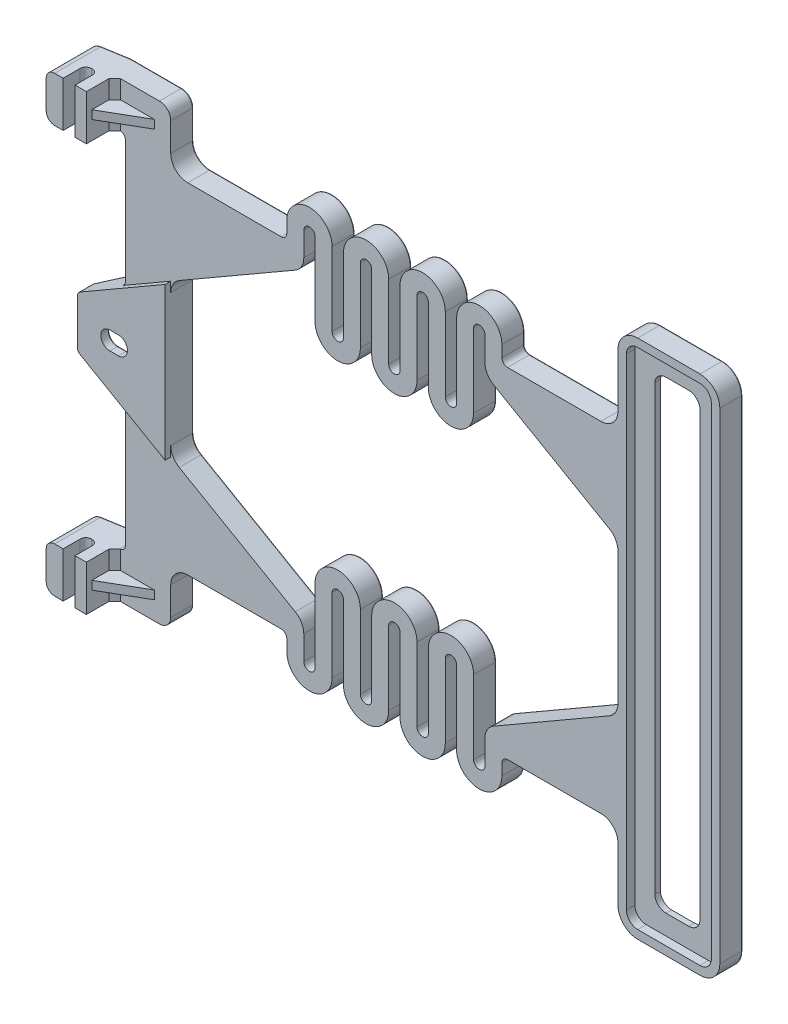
SolidWorks part; units mm, degrees
ref_plane "Face" through (0, 0, 0) normal (0, 0, 1) x (1, 0, 0)
ref_plane "Dessus" through (0, 0, 0) normal (0, 1, 0) x (1, 0, 0)
ref_plane "Droite" through (0, 0, 0) normal (1, 0, 0) x (0, 0, -1)
sketch "Esquisse1" plane through (0, 0, 0) normal (0, 0, 1) x (1, 0, 0)
  line L0 (0, 0) -> (-48.5, 0) construction
  line L1 (-21, 30) -> (-16, 30)
  line L2 (-16, 30) -> (-16, -30)
  line L3 (-21, -30) -> (-16, -30)
  line L4 (-21, -30) -> (-21, 30)
  point P8 (-16, 0)
  dimension "D1" = 16
  dimension "D2" = 60
  dimension "D3" = 5
extrude "Extrusion1" add sketch "Esquisse1" along normal mid plane 4
sketch "Esquisse2" plane through (0, 0, 0) normal (0, 0, 1) x (1, 0, 0)
  line L0 (-17.5, 30) -> (-17.5, 33)
  line L1 (-16, 30) -> (-21, 30) construction
  line L2 (-15, 33) -> (25.6137, 33) construction
  line L3 (-12.5, 33) -> (-12.5, 20)
  line L4 (-10, 20) -> (25.6137, 20) construction
  line L5 (-7.5, 20) -> (-7.5, 33)
  line L6 (2.5, 20) -> (2.5, 33)
  line L7 (-2.5, 33) -> (-2.5, 20)
  line L8 (7.5, 33) -> (7.5, 20)
  line L9 (12.5, 20) -> (12.5, 33)
  line L10 (17.5, 33) -> (17.5, 30)
  arc A0 (-12.5, 33) -> (-17.5, 33) centre (-15, 33) ccw
  arc A1 (-2.5, 33) -> (-7.5, 33) centre (-5, 33) ccw
  arc A2 (-12.5, 20) -> (-7.5, 20) centre (-10, 20) ccw
  arc A3 (-2.5, 20) -> (2.5, 20) centre (0, 20) ccw
  arc A4 (7.5, 33) -> (2.5, 33) centre (5, 33) ccw
  arc A5 (7.5, 20) -> (12.5, 20) centre (10, 20) ccw
  arc A6 (17.5, 33) -> (12.5, 33) centre (15, 33) ccw
  dimension "D8" = 13
  dimension "D1" = 33
  dimension "D2" = 5
  dimension "D3" = 2.5
  dimension "D4" = 5
  dimension "D5" = 17.5
sketch "Esquisse3" plane through (0, 30, 0) normal (0, 1, 0) x (-1, 0, 0)
  line L0 (16, 2) -> (21, 2) construction
  line L1 (16, -2) -> (19, -2)
  line L2 (16, -2) -> (16, 2)
  line L3 (16, 2) -> (19, 2)
  line L4 (19, -2) -> (19, 2)
  dimension "D1" = 3
sweep "Balayage1" add profiles "Esquisse3" path "Esquisse2"
mirror "Symétrie2" about plane through (0, 0, 0) normal (0, 1, 0)
mirror "Symétrie3" about plane through (0, 0, 0) normal (1, 0, 0)
sketch "Esquisse5" plane through (0, 0, 0) normal (0, 0, 1) x (1, 0, 0)
  line L0 (-21, 30) -> (-21, -30) construction
  line L1 (-21, 30) -> (-21, -30)
  line L2 (-21, 30) -> (-39.5, 30)
  line L3 (-39.5, 40) -> (-41.5, 40)
  line L4 (-41.5, 40) -> (-41.5, -40)
  line L5 (48.5, 0) -> (-52.4653, 0) construction
  line L6 (-39.5, -40) -> (-41.5, -40)
  line L7 (-21, -30) -> (-39.5, -30)
  line L8 (48.5, 50) -> (48.5, 0) construction
  line L9 (-39.5, 30) -> (-39.5, 40)
  line L10 (39.5, 46) -> (39.5, 30)
  line L11 (39.5, 30) -> (21, 30)
  line L12 (21, 30) -> (21, -30)
  line L13 (57.5, 46) -> (57.5, -46)
  line L14 (39.5, -30) -> (21, -30)
  line L15 (39.5, -46) -> (39.5, -30)
  line L16 (44.5, 41) -> (44.5, -41)
  line L17 (52.5, 41) -> (52.5, -41)
  line L18 (-39.5, -30) -> (-39.5, -40)
  line L19 (44.5, -41) -> (52.5, -41)
  line L20 (44.5, 41) -> (52.5, 41)
  line L21 (39.5, -46) -> (57.5, -46)
  line L22 (39.5, 46) -> (57.5, 46)
  point P10 (-41.5, 0)
  point P11 (-21, 0)
  point P24 (57.5, 0)
  point P25 (21, 0)
  dimension "D4" = 5
  dimension "D6" = 9
  dimension "D11" = 9
  dimension "D1" = 80
  dimension "D2" = 18.5
  dimension "D3" = 2
  dimension "D5" = 50
  dimension "D7" = 48.5
  dimension "D8" = 8
  dimension "D9" = 4
  dimension "D10" = 41
  dimension "D12" = 41
extrude "Extrusion3" add sketch "Esquisse5" along normal mid plane 4
fillet "Congé1" radius 3
sketch "Esquisse6" plane through (0, 0, -2) normal (0, 0, -1) x (-1, 0, 0)
  line L0 (0, 0) -> (-92.3068, 0) construction
  line L1 (-16, 27) -> (-39.5, 13.4323)
  line L2 (-39.5, 13.4323) -> (-39.5, -13.4323)
  line L3 (-39.5, 46) -> (-39.5, 33) construction
  line L4 (-16, 33) -> (-16, -33) construction
  line L5 (-16, 27) -> (-16, -27)
  line L6 (-16, -27) -> (-39.5, -13.4323)
  line L7 (-19, 30) -> (-36.5, 30) construction
  line L8 (0, 0) -> (0, -61.8197) construction
  line L9 (16, 27) -> (16, -27)
  line L10 (16, 27) -> (39.5, 13.4323)
  line L11 (39.5, 13.4323) -> (39.5, -13.4323)
  line L12 (39.5, 33) -> (39.5, 40) construction
  line L13 (16, -27) -> (39.5, -13.4323)
  point P12 (-16, 0)
  point P13 (-39.5, 0)
  point P23 (39.5, 0)
  dimension "D1" = 3
  dimension "D2" = 60
  dimension "D3" = 60
extrude "Enlèv. mat.-Extru.1" cut sketch "Esquisse6" against normal blind 10
fillet "Congé2" radius 3
sketch "Esquisse7" plane through (0, 0, -2) normal (0, 0, -1) x (-1, 0, 0)
  line L0 (-19.634, -26.634) -> (-38, -16.0303)
  line L1 (-39.5, -16.8964) -> (-39.5, -27.5)
  line L2 (-38.5, -28.5) -> (-20.134, -28.5)
  line L3 (-36.5, -30) -> (-19, -30) construction
  line L4 (-39.5, 11.7002) -> (-39.5, -11.7002) construction
  line L5 (-38, -14.2983) -> (-17.5, -26.134) construction
  line L6 (0, 0) -> (-67.4355, 0) construction
  line L7 (-38.5, 28.5) -> (-20.134, 28.5)
  line L8 (-39.5, 16.8964) -> (-39.5, 27.5)
  line L9 (-19.634, 26.634) -> (-38, 16.0303)
  arc A0 (-19.634, -26.634) -> (-20.134, -28.5) centre (-20.134, -27.5) cw
  arc A1 (-39.5, -27.5) -> (-38.5, -28.5) centre (-38.5, -27.5) ccw
  arc A2 (-38, -16.0303) -> (-39.5, -16.8964) centre (-38.5, -16.8964) ccw
  arc A3 (-38, 16.0303) -> (-39.5, 16.8964) centre (-38.5, 16.8964) cw
  arc A4 (-39.5, 27.5) -> (-38.5, 28.5) centre (-38.5, 27.5) cw
  arc A5 (-19.634, 26.634) -> (-20.134, 28.5) centre (-20.134, 27.5) ccw
  dimension "D3" = 1
  dimension "D1" = 1.5
  dimension "D2" = 1.5
extrude "Enlèv. mat.-Extru.2" cut sketch "Esquisse7" against normal blind 2
sketch "Esquisse8" plane through (0, 0, -2) normal (0, 0, -1) x (-1, 0, 0)
  line L0 (0, 0) -> (84.6985, 0) construction
  line L1 (39.5, 13.4489) -> (55, 4.5)
  line L2 (39.5, 13.4489) -> (39.5, -13.4489)
  line L3 (39.5, -13.4489) -> (55, -4.5)
  line L4 (55, 4.5) -> (55, -4.5)
  line L5 (39.5, -11.7002) -> (39.5, 11.7002) construction
  line L6 (47.75, 1.6) -> (49.25, 1.6)
  line L7 (47.75, -1.6) -> (49.25, -1.6)
  arc A0 (47.75, 1.6) -> (47.75, -1.6) centre (47.75, 0) ccw
  arc A1 (49.25, -1.6) -> (49.25, 1.6) centre (49.25, 0) ccw
  point P2 (55, 0)
  point P10 (39.5, 0)
  dimension "D3" = 3.2
  dimension "D1" = 47.75
  dimension "D2" = 55
  dimension "D4" = 60
  dimension "D5" = 1.5
  dimension "D6" = 9
extrude "Extrusion4" add sketch "Esquisse8" against normal blind 5
sketch "Esquisse9" plane through (0, 0, 2) normal (0, 0, 1) x (1, 0, 0)
  line L0 (41, -44.5) -> (56, -44.5)
  line L1 (41, 44.5505) -> (56, 44.5505)
  line L2 (57.5, 46) -> (39.5, 46) construction
  line L3 (39.5, -46) -> (57.5, -46) construction
  line L4 (56, -44.5) -> (56, 44.5)
  line L5 (41, 44.5) -> (41, -44.5)
  line L6 (56, -44.5) -> (56, 44.5505)
  line L7 (41, 44.5505) -> (41, -44.5)
  arc A4 (41, -44.5) -> (56, -44.5) centre (48.5, -50) ccw
  arc A5 (56, 44.5) -> (41, 44.5) centre (48.5, 50) ccw
  dimension "D2" = 1.4495
  dimension "D3" = 1.5
  dimension "D1" = 3.5
extrude "Enlèv. mat.-Extru.3" cut sketch "Esquisse9" against normal blind 1.5
mirror "Symétrie5" about plane through (0, 0, 0) normal (0, 0, 1)
sketch "Esquisse10" plane through (0, 0, -2) normal (0, 0, -1) x (-1, 0, 0)
  line L0 (47.5, 5.9641) -> (41.5, 2.5)
  line L1 (41.5, 40) -> (41.5, 12.2942) construction
  line L2 (41.5, 2.5) -> (41.5, 40)
  line L3 (41.5, 40) -> (56.5, 40)
  line L4 (47.5, 32) -> (47.5, 5.9641)
  line L8 (56.5, 32) -> (56.5, 40)
  line L9 (56.5, 32) -> (47.5, 32)
  dimension "D1" = 60
  dimension "D2" = 6
  dimension "D3" = 15
  dimension "D4" = 2.5
  dimension "D5" = 8
extrude "Extrusion5" add sketch "Esquisse10" along normal up to surface (4 mm away)
mirror "Symétrie8" about plane through (0, 0, 0) normal (0, 1, 0)
fillet "Congé8" radius 2
fillet "Congé9" radius 3.5
fillet "Congé14" radius 2
fillet "Congé16" radius 1
fillet "Congé20" radius 1
sketch "Esquisse20" plane through (0, 0, 2) normal (0, 0, 1) x (1, 0, 0)
  line L0 (-56.5, 32) -> (-48.5, 32) construction
  line L1 (-56.5, 40) -> (-53.5, 40)
  line L2 (-56.5, 40) -> (-56.5, 32)
  line L3 (-56.5, 32) -> (-53.5, 32)
  line L4 (-53.5, 40) -> (-53.5, 32)
  line L5 (0, 0) -> (-78.4526, 0) construction
  line L6 (-53.5, -40) -> (-53.5, -32)
  line L7 (-56.5, -32) -> (-53.5, -32)
  line L8 (-56.5, -40) -> (-56.5, -32)
  line L9 (-56.5, -40) -> (-53.5, -40)
  dimension "D1" = 3
extrude "Extrusion12" add sketch "Esquisse20" along normal blind 5
chamfer "Chanfrein1" distance 6 distance2 1
sketch "Esquisse21" plane through (0, 0, 2) normal (0, 0, 1) x (1, 0, 0)
  line L0 (-41.5, 40) -> (-53.5, 40) construction
  line L1 (-51.4, 40) -> (-49.4, 40)
  line L2 (-51.4, 40) -> (-51.4, 32)
  line L3 (-51.4, 32) -> (-49.4, 32)
  line L4 (-49.4, 40) -> (-49.4, 32)
  line L5 (-53.5, 32) -> (-48.5, 32) construction
  line L6 (-53.5, 32) -> (-53.5, 40) construction
  line L7 (0, 0) -> (-83.1905, 0) construction
  line L8 (-49.4, -40) -> (-49.4, -32)
  line L9 (-51.4, -32) -> (-49.4, -32)
  line L10 (-51.4, -40) -> (-51.4, -32)
  line L11 (-51.4, -40) -> (-49.4, -40)
  dimension "D1" = 2.1
  dimension "D2" = 2
extrude "Extrusion14" add sketch "Esquisse21" along normal up to surface (5 mm away)
chamfer "Chanfrein3" distance 1 angle 45
sketch "Esquisse22" plane through (0, 0, 2) normal (0, 0, 1) x (1, 0, 0)
  line L4 (-51.4, -40) -> (-51.4, -32)
  line L5 (-51.4, -32) -> (-53.5, -32)
  line L6 (-53.5, -32) -> (-53.5, -40)
  line L7 (-53.5, -40) -> (-51.4, -40)
  line L8 (-51.4, -40) -> (-51.4, -32)
  line L9 (-51.4, -32) -> (-53.5, -32)
  line L10 (-53.5, -32) -> (-53.5, -40)
  line L11 (-53.5, -40) -> (-51.4, -40)
  line L12 (-51.4, 32) -> (-51.4, 40)
  line L13 (-51.4, 40) -> (-53.5, 40)
  line L14 (-53.5, 40) -> (-53.5, 32)
  line L15 (-53.5, 32) -> (-51.4, 32)
  line L16 (-51.4, 32) -> (-51.4, 40)
  line L17 (-51.4, 40) -> (-53.5, 40)
  line L18 (-53.5, 40) -> (-53.5, 32)
  line L19 (-53.5, 32) -> (-51.4, 32)
  dimension "D1" = 0
  dimension "D2" = 0
extrude "Extrusion15" add sketch "Esquisse22" along normal blind 1
fillet "Congé22" radius 1
sketch "Esquisse23" plane through (0, 0, -2) normal (0, 0, -1) x (-1, 0, 0)
  line L100 (0, 0) -> (71.6749, 0) construction
  line L101 (46, -9.4075) -> (46, -31)
  line L102 (41, -11.7002) -> (41, 11.7002)
  line L103 (38.75, 15.5973) -> (18.25, 27.433)
  line L104 (41, -11.7002) -> (41, 11.7002)
  line L105 (38.75, 15.5973) -> (19.634, 26.634)
  line L106 (53.4, -3.6917) -> (47.25, -7.2424)
  line L107 (36.5, -28.5) -> (20.134, -28.5)
  line L108 (41, -38) -> (41, -33)
  line L109 (48.8, -38.5) -> (41.5, -38.5)
  line L110 (49, -33.7) -> (49, -38.3)
  line L111 (48.5, -33.5) -> (48.8, -33.5)
  line L112 (38.75, -15.5973) -> (19.634, -26.634)
  line L136 (48.5, 33.5) -> (49, 33.5)
  line L137 (49, 33.5) -> (49, 38.5)
  line L138 (49, 38.5) -> (41.5, 38.5)
  line L139 (41, 38) -> (41, 33)
  line L140 (36.5, 28.5) -> (20, 28.5)
  line L141 (17.5, 31) -> (17.5, 33)
  line L142 (12.5, 33) -> (12.5, 20)
  line L143 (7.5, 20) -> (7.5, 33)
  line L144 (2.5, 33) -> (2.5, 20)
  line L145 (-2.5, 20) -> (-2.5, 33)
  line L146 (-7.5, 33) -> (-7.5, 20)
  line L147 (-12.5, 20) -> (-12.5, 33)
  line L148 (-17.5, 33) -> (-17.5, 31)
  line L149 (-20, 28.5) -> (-36.5, 28.5)
  line L150 (-41, 33) -> (-41, 42.5)
  line L151 (-43, 44.5) -> (-54, 44.5)
  line L152 (-56, 42.5) -> (-56, -42.5)
  line L153 (-54, -44.5) -> (-43, -44.5)
  line L154 (-41, -42.5) -> (-41, -33)
  line L155 (-36.5, -28.5) -> (-20, -28.5)
  line L156 (-17.5, -31) -> (-17.5, -33)
  line L157 (-12.5, -33) -> (-12.5, -20)
  line L158 (-7.5, -20) -> (-7.5, -33)
  line L159 (-2.5, -33) -> (-2.5, -20)
  line L160 (2.5, -20) -> (2.5, -33)
  line L161 (7.5, -33) -> (7.5, -20)
  line L162 (12.5, -20) -> (12.5, -33)
  line L163 (17.5, -33) -> (17.5, -31)
  line L164 (20, -28.5) -> (36.5, -28.5)
  line L165 (41, -33) -> (41, -38)
  line L166 (41.5, -38.5) -> (49, -38.5)
  line L167 (49, -38.5) -> (49, -33.5)
  line L168 (49, -33.5) -> (48.5, -33.5)
  line L169 (46, -31) -> (46, -9.4075)
  line L170 (47.25, -7.2424) -> (53.5, -3.634)
  line L171 (53.5, -3.634) -> (53.5, 3.634)
  line L172 (53.5, 3.634) -> (47.25, 7.2424)
  line L173 (46, 9.4075) -> (46, 31)
  line L174 (48.5, 33.5) -> (48.8, 33.5)
  line L175 (49, 33.7) -> (49, 38.3)
  line L176 (48.8, 38.5) -> (41.5, 38.5)
  line L177 (41, 38) -> (41, 33)
  line L178 (36.5, 28.5) -> (20.134, 28.5)
  line L209 (53.5, -3.5185) -> (53.5, 3.5185)
  line L210 (53.4, 3.6917) -> (47.25, 7.2424)
  line L211 (46, 9.4075) -> (46, 31)
  arc A71 (19.634, 26.634) -> (20.134, 28.5) centre (20.134, 27.5) cw
  arc A72 (41, 11.7002) -> (38.75, 15.5973) centre (36.5, 11.7002) ccw
  arc A73 (41, 11.7002) -> (38.75, 15.5973) centre (36.5, 11.7002) ccw
  arc A74 (49, 38.3) -> (48.8, 38.5) centre (48.8, 38.3) ccw
  arc A75 (48.8, 33.5) -> (49, 33.7) centre (48.8, 33.7) ccw
  arc A76 (53.5, 3.5185) -> (53.4, 3.6917) centre (53.3, 3.5185) ccw
  arc A77 (48.5, -33.5) -> (46, -31) centre (48.5, -31) cw
  arc A78 (46, -9.4075) -> (47.25, -7.2424) centre (48.5, -9.4075) cw
  arc A79 (36.5, -28.5) -> (41, -33) centre (36.5, -33) cw
  arc A80 (41.5, -38.5) -> (41, -38) centre (41.5, -38) cw
  arc A81 (53.5, -3.5185) -> (53.4, -3.6917) centre (53.3, -3.5185) cw
  arc A82 (48.8, -33.5) -> (49, -33.7) centre (48.8, -33.7) cw
  arc A83 (49, -38.3) -> (48.8, -38.5) centre (48.8, -38.3) cw
  arc A84 (41, -11.7002) -> (38.75, -15.5973) centre (36.5, -11.7002) cw
  arc A85 (19.634, -26.634) -> (20.134, -28.5) centre (20.134, -27.5) ccw
  arc A104 (41.5, 38.5) -> (41, 38) centre (41.5, 38) ccw
  arc A105 (36.5, 28.5) -> (41, 33) centre (36.5, 33) ccw
  arc A106 (17.5, 31) -> (20, 28.5) centre (20, 31) ccw
  arc A107 (17.5, 33) -> (12.5, 33) centre (15, 33) ccw
  arc A108 (7.5, 20) -> (12.5, 20) centre (10, 20) ccw
  arc A109 (7.5, 33) -> (2.5, 33) centre (5, 33) ccw
  arc A110 (-2.5, 20) -> (2.5, 20) centre (0, 20) ccw
  arc A111 (-2.5, 33) -> (-7.5, 33) centre (-5, 33) ccw
  arc A112 (-12.5, 20) -> (-7.5, 20) centre (-10, 20) ccw
  arc A113 (-12.5, 33) -> (-17.5, 33) centre (-15, 33) ccw
  arc A114 (-20, 28.5) -> (-17.5, 31) centre (-20, 31) ccw
  arc A115 (-41, 33) -> (-36.5, 28.5) centre (-36.5, 33) ccw
  arc A116 (-41, 42.5) -> (-43, 44.5) centre (-43, 42.5) ccw
  arc A117 (-54, 44.5) -> (-56, 42.5) centre (-54, 42.5) ccw
  arc A118 (-56, -42.5) -> (-54, -44.5) centre (-54, -42.5) ccw
  arc A119 (-43, -44.5) -> (-41, -42.5) centre (-43, -42.5) ccw
  arc A120 (-36.5, -28.5) -> (-41, -33) centre (-36.5, -33) ccw
  arc A121 (-17.5, -31) -> (-20, -28.5) centre (-20, -31) ccw
  arc A122 (-17.5, -33) -> (-12.5, -33) centre (-15, -33) ccw
  arc A123 (-7.5, -20) -> (-12.5, -20) centre (-10, -20) ccw
  arc A124 (-7.5, -33) -> (-2.5, -33) centre (-5, -33) ccw
  arc A125 (2.5, -20) -> (-2.5, -20) centre (0, -20) ccw
  arc A126 (2.5, -33) -> (7.5, -33) centre (5, -33) ccw
  arc A127 (12.5, -20) -> (7.5, -20) centre (10, -20) ccw
  arc A128 (12.5, -33) -> (17.5, -33) centre (15, -33) ccw
  arc A129 (20, -28.5) -> (17.5, -31) centre (20, -31) ccw
  arc A130 (41, -33) -> (36.5, -28.5) centre (36.5, -33) ccw
  arc A131 (41, -38) -> (41.5, -38.5) centre (41.5, -38) ccw
  arc A132 (46, -31) -> (48.5, -33.5) centre (48.5, -31) ccw
  arc A133 (47.25, -7.2424) -> (46, -9.4075) centre (48.5, -9.4075) ccw
  arc A134 (46, 9.4075) -> (47.25, 7.2424) centre (48.5, 9.4075) ccw
  arc A135 (48.5, 33.5) -> (46, 31) centre (48.5, 31) ccw
  arc A136 (41.5, 38.5) -> (41, 38) centre (41.5, 38) ccw
  arc A137 (36.5, 28.5) -> (41, 33) centre (36.5, 33) ccw
  arc A166 (46, 9.4075) -> (47.25, 7.2424) centre (48.5, 9.4075) ccw
  arc A167 (48.5, 33.5) -> (46, 31) centre (48.5, 31) ccw
  point P17 (41, 0)
  point P35 (53.5, 0)
  dimension "D3" = 1
  dimension "D4" = 0.2
  dimension "D1" = 1.5
  dimension "D2" = 1.5
extrude "Enlèv. mat.-Extru.4" cut sketch "Esquisse23" against normal blind 2
sketch "Esquisse24" plane through (0, 0, 0) normal (0, 0, -1) x (-1, 0, 0)
  line L0 (53.5, -3.5185) -> (53.5, 3.5185) construction
  line L1 (53.4, 3.6917) -> (47.25, 7.2424) construction
  line L2 (41, 11.7002) -> (41, -11.7002) construction
  line L3 (47.25, -7.2424) -> (53.4, -3.6917) construction
  line L4 (41, 10.8509) -> (41, -10.8509)
  line L5 (41, -10.8509) -> (53.4, -3.6917)
  line L6 (53.5, -3.5185) -> (53.5, 3.5185)
  line L7 (53.4, 3.6917) -> (41, 10.8509)
  arc A0 (53.5, 3.5185) -> (53.4, 3.6917) centre (53.3, 3.5185) ccw construction
  arc A1 (53.4, -3.6917) -> (53.5, -3.5185) centre (53.3, -3.5185) ccw construction
  arc A2 (53.4, -3.6917) -> (53.5, -3.5185) centre (53.3, -3.5185) ccw
  arc A3 (53.5, 3.5185) -> (53.4, 3.6917) centre (53.3, 3.5185) ccw
extrude "Enlèv. mat.-Extru.5" cut sketch "Esquisse24" against normal blind 1.5
sketch "Esquisse25" plane through (0, 0, 0) normal (0, 1, 0) x (1, 0, 0)
  line L0 (-55, -0.5) -> (-48, 2)
  line L1 (-55, -3) -> (-55, 2) construction
  line L2 (-41.5, 2) -> (-50.5, 2) construction
  line L3 (-48, 2) -> (-55, 2)
  line L4 (-55, 2) -> (-55, -0.5)
  dimension "D1" = 7
  dimension "D2" = 2.5
extrude "Enlèv. mat.-Extru.6" cut sketch "Esquisse25" against normal mid plane 22
sketch "Esquisse26" plane through (0, 0, 0) normal (0, 0, -1) x (-1, 0, 0)
  line L0 (48.8, 38.5) -> (41.5, 38.5) construction
  line L1 (48.5, 33.5) -> (48.8, 33.5) construction
  line L2 (54, 38.5) -> (48.5, 38.5)
  line L3 (48.5, 33.5) -> (54, 33.5)
  line L4 (55, 37.5) -> (55, 34.5)
  line L5 (56.5, 40) -> (56.5, 32) construction
  line L6 (48.5, 33.5) -> (48.5, 38.5)
  line L7 (0, 0) -> (66.9914, 0) construction
  line L8 (48.5, -33.5) -> (48.5, -38.5)
  line L9 (55, -37.5) -> (55, -34.5)
  line L10 (48.5, -33.5) -> (54, -33.5)
  line L11 (54, -38.5) -> (48.5, -38.5)
  arc A0 (55, 37.5) -> (54, 38.5) centre (54, 37.5) ccw
  arc A1 (54, 33.5) -> (55, 34.5) centre (54, 34.5) ccw
  arc A2 (54, -33.5) -> (55, -34.5) centre (54, -34.5) cw
  arc A3 (55, -37.5) -> (54, -38.5) centre (54, -37.5) cw
  dimension "D2" = 1
  dimension "D1" = 1.5
extrude "Enlèv. mat.-Extru.7" cut sketch "Esquisse26" along normal blind 22
ref_plane "Plan1" through (0, 36, 0) normal (0, 1, 0) x (-1, 0, 0)
sketch "Esquisse27" plane through (0, 36, 0) normal (0, 1, 0) x (-1, 0, 0)
  line L0 (49.4, 7) -> (49.4, 3) construction
  line L1 (49.4, 3) -> (48.4, 2) construction
  line L2 (41.5, 2) -> (48.4, 2) construction
  line L3 (49.4, 6.0415) -> (49.4, 3)
  line L4 (49.4, 3) -> (48.4, 2)
  line L5 (42.4, 2) -> (48.4, 2)
  line L6 (49.4, 6.0415) -> (42.4, 2)
  dimension "D1" = 30
  dimension "D2" = 7
extrude "Extrusion16" add sketch "Esquisse27" along normal mid plane 1.5
mirror "Symétrie9" about plane through (0, 0, 0) normal (0, 1, 0)
fillet "Congé23" radius 0.5
fillet "Congé25" radius 1.5
fillet "Congé24" radius 0.2
sketch "Esquisse28" plane through (0, 0, 0) normal (0, 1, 0) x (1, 0, 0)
  line L0 (48.5, 0.5) -> (48.5, -8.1924) construction
  line L1 (54, 0.5) -> (43, 0.5) construction
  line L2 (43.5478, 0.5) -> (44.5438, 0.5)
  line L3 (43.5478, -0.5) -> (44.521, -0.5)
  line L5 (43.5478, 0.5) -> (43.5478, -0.5)
  line L7 (53.4522, 0.5) -> (53.4522, -0.5)
  line L8 (53.4522, -0.5) -> (52.479, -0.5)
  line L9 (53.4522, 0.5) -> (52.4562, 0.5)
  arc A0 (44.5438, 0.5) -> (44.521, -0.5) centre (48.5, -0.0906) ccw
  arc A1 (52.4562, 0.5) -> (52.479, -0.5) centre (48.5, -0.0906) cw
  dimension "D1" = 8
extrude "Extrusion17" add sketch "Esquisse28" along normal mid plane 80
